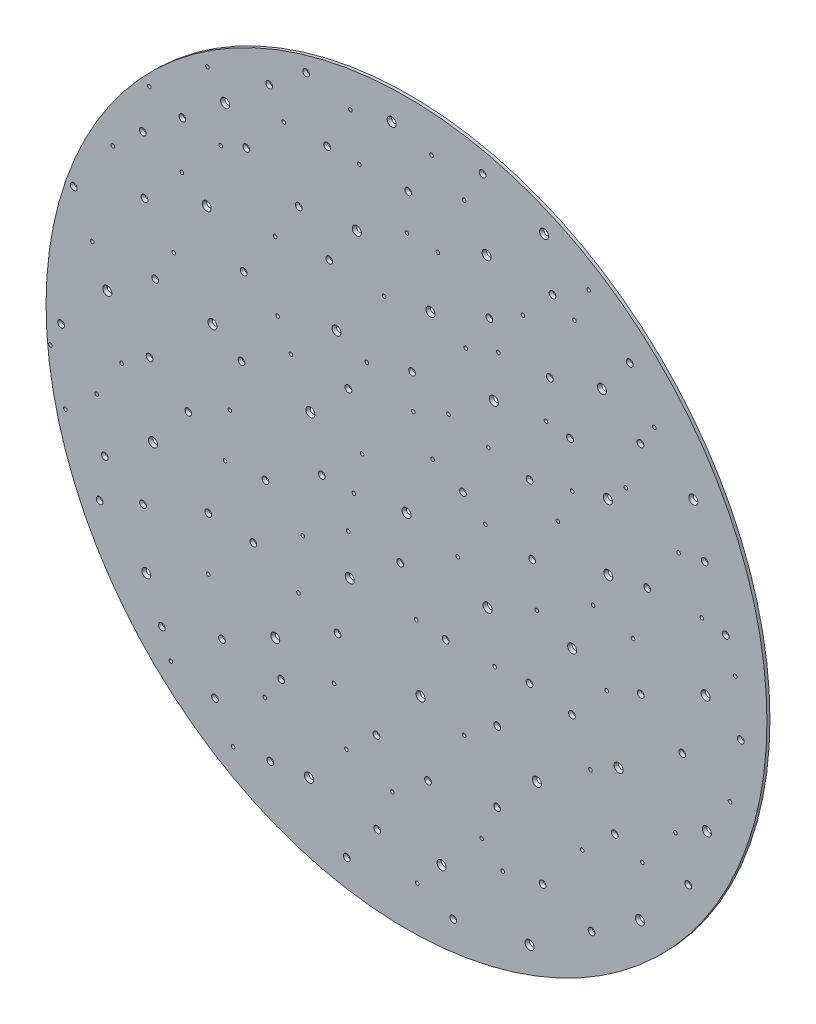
SolidWorks part; units mm, degrees
ref_plane "Ebene vorne" through (0, 0, 0) normal (0, 0, 1) x (1, 0, 0)
ref_plane "Ebene oben" through (0, 0, 0) normal (0, 1, 0) x (1, 0, 0)
ref_plane "Ebene rechts" through (0, 0, 0) normal (1, 0, 0) x (0, 0, -1)
sketch "Skizze1" plane through (0, 0, 0) normal (0, 0, 1) x (1, 0, 0)
  circle A0 centre (0, 0) radius 1200
ref_plane "Ebene1" through (0, 0, 10) normal (0, 0, 1) x (1, 0, 0)
ref_plane "Ebene2" through (0, 0, 20) normal (0, 0, 1) x (1, 0, 0)
extrude "Aufsatz-Linear austragen1" add sketch "Skizze1" against normal blind 10
hole_wizard "Bohrung1" positions "Skizze4" profile "Skizze3" legacy
sketch "Skizze4" plane through (0, 0, 0) normal (0, 0, 1) x (1, 0, 0)
  point P0 (0, 0)
  point P1 (290.6781, 468.5945)
  point P3 (671.8047, 156.7542)
  point P5 (79.9076, 619.5115)
  point P7 (-233.0564, 409.2269)
  point P9 (-319.9427, 129.9313)
  point P11 (46.922, -505.7164)
  point P13 (551.6068, -115.1658)
  point P15 (-436.9488, -578.6489)
  point P17 (-843.7334, -218.48)
  point P19 (-645.9548, 221.069)
  point P21 (-603.776, 879.8761)
  point P23 (-49.4273, 1103.0558)
  point P25 (457.8986, 1033.375)
  point P27 (-165.2758, 730.6617)
  point P29 (954.7613, 515.8416)
  point P31 (777.0213, -785.8353)
  point P33 (999.9071, -418.1861)
  point P35 (434.1062, -558.2735)
  point P37 (116.7367, -957.1277)
  point P39 (-324.5169, -925.7692)
  point P41 (-866.1995, -606.8116)
  point P43 (-188.9558, -282.8995)
  point P45 (269.8078, -138.0672)
  point P47 (995.6139, -28.6683)
  point P49 (650.6085, 682.696)
  point P51 (-665.0044, 552.2519)
  point P53 (-996.0289, 142.2053)
  point P55 (409.4373, -1040.8898)
  point P57 (706.1051, -381.5663)
  point P59 (670.2088, 375.0843)
  point P61 (266.7284, 876.6803)
sketch "Skizze3" plane through (0, 0, 0) normal (1, 0, 0) x (0, -1, 0)
  line L0 (0, 0) -> (0, 16.0086)
  line L1 (0, 16.0086) -> (10, 10)
  line L2 (10, 10) -> (15, 0)
  line L3 (15, 0) -> (0, 0)
  line L4 (0, -9.9017) -> (0, 117.2029) construction
  line L5 (0, 16.0086) -> (-10, 10) construction
  dimension "Unterer Durchmesser" = 20
  dimension "Tiefe" = 10
  dimension "Oberer Durchmesser" = 30
  dimension "Spitzenwinkel" = 118
hole_wizard "Bohrung7" positions "Skizze15" profile "Skizze14" legacy
sketch "Skizze15" plane through (0, 0, 0) normal (0, 0, 1) x (1, 0, 0)
  point P0 (188.1945, 153.5734)
  point P1 (-542.0037, 424.0758)
  point P3 (-358.7942, 703.9025)
  point P5 (-746.1132, 765.8577)
  point P7 (-872.1591, 470.8258)
  point P9 (-726.8313, -72.4043)
  point P11 (-469.5952, -140.8281)
  point P13 (-659.8735, -330.7674)
  point P15 (-1004.3709, -338.8738)
  point P17 (-1149.903, -30.2747)
  point P19 (-614.4287, -671.415)
  point P21 (-637.4576, -853.0378)
  point P23 (-99.8544, -690.947)
  point P25 (-97.2312, -961.5329)
  point P27 (71.6363, -736.5628)
  point P29 (453.1981, -843.9237)
  point P31 (693.5711, -579.3024)
  point P33 (409.3714, -286.6224)
  point P35 (130.6223, -300.4834)
  point P37 (-20.7692, -154.6055)
  point P39 (-229.733, -462.7843)
  point P41 (-282.2466, -32.2494)
  point P43 (-264.2598, 925.1764)
  point P45 (18.3219, 415.8428)
  point P47 (5.9045, 929.5866)
  point P49 (-334.1472, 1102.1788)
  point P51 (253.3464, 1104.3206)
  point P53 (477.3508, 628.1698)
  point P55 (486.1398, 872.2516)
  point P57 (743.3759, 803.8279)
  point P59 (778.9244, 589.0224)
  point P61 (409.8822, 299.9552)
  point P63 (418.2626, 74.7749)
  point P65 (-193.3672, 260.9344)
  point P67 (-549.379, 162.0166)
  point P69 (-1108.0865, 386.9032)
  point P71 (-417.1837, -688.6786)
  point P73 (-453.1408, -943.1352)
  point P75 (993.1345, 356.0294)
  point P77 (1112.8102, -98.2376)
  point P79 (779.7251, -132.8482)
  point P81 (801.4424, 184.0675)
  point P83 (1063.022, 179.027)
  point P85 (918.2906, -234.2445)
  point P87 (301.8065, -698.0458)
  point P89 (-198.8345, -1092.9195)
  point P91 (-877.2177, -413.766)
  point P93 (-836.6106, 256.0204)
  point P95 (-877.712, 660.0512)
  point P97 (-457.1613, 1005.823)
  point P99 (275.8645, 699.3657)
  point P101 (-509.7936, -341.3523)
  point P103 (937.9812, -603.2445)
  point P105 (616.104, -898.9903)
  point P107 (155.6614, -1093.3398)
  point P109 (-814.6034, -735.5121)
  point P111 (-1021.6425, -475.0909)
  point P113 (-855.3982, 20.4653)
  point P115 (544.4107, 487.1223)
  point P117 (-257.3953, 600.658)
  point P119 (-533.1125, 785.4732)
  point P121 (302.0109, -463.4147)
  point P123 (550.8665, -306.6582)
sketch "Skizze14" plane through (188.1945, 153.5734, 0) normal (1, 0, 0) x (0, -1, 0)
  line L0 (0, 0) -> (0, 10)
  line L1 (0, 10) -> (7.5, 10)
  line L2 (7.5, 10) -> (11.25, 0)
  line L3 (11.25, 0) -> (0, 0)
  line L4 (0, 110) -> (0, -10) construction
  dimension "Unterer Durchmesser" = 15
  dimension "Tiefe" = 10
  dimension "Oberer Durchmesser" = 22.5
hole_wizard "Bohrung9" positions "Skizze19" profile "Skizze18" legacy
sketch "Skizze19" plane through (0, 0, 0) normal (0, 0, 1) x (1, 0, 0)
  point P0 (-131.8091, 367.77)
  point P1 (104.4248, 803.6393)
  point P3 (-429.1414, 352.985)
  point P5 (83.2184, 1073.3012)
  point P7 (-437.5218, 578.1653)
  point P9 (-1046.7327, 259.1078)
  point P11 (-977.8504, 569.3449)
  point P13 (-948.3657, -42.8128)
  point P15 (-1031.3857, -173.2753)
  point P17 (-1185.7069, -108.758)
  point P19 (-1135.8164, -268.707)
  point P21 (-660.0268, -506.7407)
  point P23 (-345.3206, -238.4231)
  point P25 (-241.2985, -612.2535)
  point P27 (-199.9928, -781.6533)
  point P29 (-47.0854, -828.1931)
  point P31 (320.2366, -873.095)
  point P33 (35.6281, -1049.6772)
  point P35 (31.9998, -291.8516)
  point P37 (-147.7692, 96.26)
  point P39 (-588.1126, 2.1726)
  point P41 (139.769, 354.2028)
  point P43 (-74.4412, 587.1958)
  point P45 (-157.0525, 925.9954)
  point P47 (-186.9459, 1068.891)
  point P49 (-663.0421, 954.978)
  point P51 (-384.906, 264.9458)
  point P53 (-775.0525, 362.856)
  point P55 (-603.9705, -152.0219)
  point P57 (262.4765, 98.6119)
  point P59 (170.8718, -41.3014)
  point P61 (433.8651, -64.3194)
  point P63 (293.5794, -296.8922)
  point P65 (191.8739, -545.5943)
  point P67 (584.848, -679.4594)
  point P69 (612.2203, -434.4536)
  point P71 (895.2106, -474.525)
  point P73 (785.0226, -615.3624)
  point P75 (666.7607, -179.0729)
  point P77 (621.2137, 44.2593)
  point P79 (754.1241, 14.7728)
  point P81 (982.9827, 188.5828)
  point P83 (1076.9042, -294.0365)
  point P85 (1094.3802, 76.8116)
  point P87 (730.1923, 437.7052)
  point P89 (905.9243, 338.157)
  point P91 (824.7267, 658.9791)
  point P93 (551.4284, 338.5772)
  point P95 (504.1612, 227.9403)
  point P97 (387.4152, 763.5678)
  point P99 (606.2753, 945.9045)
  point P101 (559.0081, 835.2676)
  point P103 (464.3715, 496.6781)
  point P105 (272.6794, 324.7163)
  point P107 (22.5121, 303.2527)
  point P109 (-175.0393, -31.4304)
  point P111 (86.7445, 198.1601)
  point P113 (-193.7248, -149.6699)
  point P115 (-359.7648, -410.595)
  point P117 (191.7883, 997.485)
  point P119 (197.1369, 573.6285)
  point P121 (305.809, 615.1278)
  point P123 (1.51, 807.5456)
  point P125 (-408.6335, 922.5092)
  point P127 (-618.9089, 749.6233)
  point P129 (-747.6802, 607.8619)
  point P131 (-856.1479, 800.9936)
  point P133 (-471.5709, -768.086)
  point P135 (-577.5176, -962.8557)
  point P137 (-784.6589, -819.75)
  point P139 (250.2469, -813.4081)
sketch "Skizze18" plane through (-131.8091, 367.77, 0) normal (1, 0, 0) x (0, -1, 0)
  line L0 (0, 0) -> (0, 10)
  line L1 (0, 10) -> (4, 10)
  line L2 (4, 10) -> (6, 0)
  line L3 (6, 0) -> (0, 0)
  line L4 (0, 110) -> (0, -10) construction
  dimension "Unterer Durchmesser" = 8
  dimension "Tiefe" = 10
  dimension "Oberer Durchmesser" = 12
ref_plane "Hügelextrema" through (0, 0, 30) normal (0, 0, 1) x (1, 0, 0)
ref_plane "Ebene6" through (0, 0, 130) normal (0, 0, 1) x (1, 0, 0)
